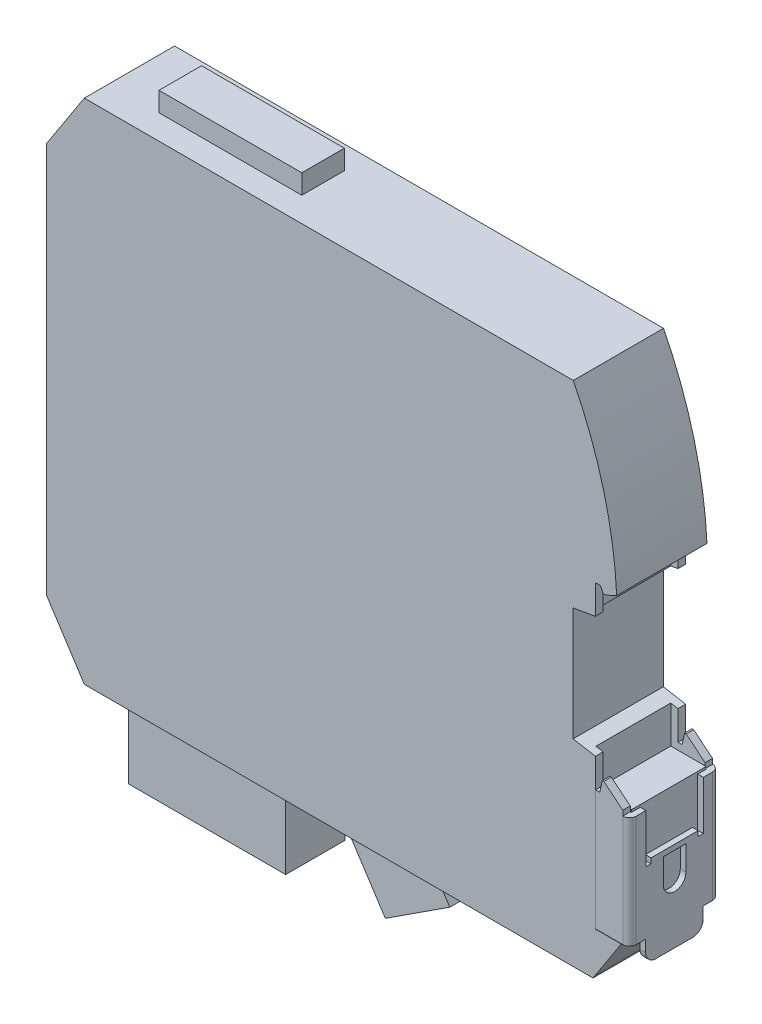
SolidWorks part; units mm, degrees
ref_plane "Front" through (0, 0, 0) normal (0, 0, 1) x (1, 0, 0)
ref_plane "Top" through (0, 0, 0) normal (0, 1, 0) x (1, 0, 0)
ref_plane "Right" through (0, 0, 0) normal (1, 0, 0) x (0, 0, -1)
sketch "Sketch1" plane through (0, 0, 0) normal (0, 0, 1) x (1, 0, 0)
  line L1 (57.2807, 0) -> (57.2807, -2.5863) construction
  line L2 (7.3383, 99) -> (9.1269, 99)
  line L3 (0, 87.7) -> (7.3383, 99)
  line L4 (-36.1695, 0) -> (36.1695, 0) construction
  line L5 (0, 0) -> (0, 109.5612) construction
  line L6 (75.1662, 0) -> (75.1662, -1.4017) construction
  line L7 (0, 11.3) -> (0, 87.7)
  line L12 (102.6923, 99) -> (176.6242, 99) construction
  line L13 (102.6923, 99) -> (102.6923, 151.5645) construction
  line L14 (0, 11.3) -> (0, -19.5306) construction
  line L15 (7.3383, 0) -> (0, 11.3)
  line L17 (7.3383, 0) -> (-18.9009, 0) construction
  line L26 (78.1, 0) -> (104.5, 0)
  line L29 (113.6, 6.2) -> (113.6, 4.2)
  line L31 (107, 8.5) -> (107, 14.7)
  line L33 (112.3, 31.2) -> (112.3, 30.2)
  line L34 (108.6, 34.2) -> (112.3, 31.2)
  line L35 (108.3, 34.2) -> (108.6, 34.2)
  line L36 (107.8, 32) -> (108.3, 34.2)
  line L37 (107, 32) -> (107.8, 32)
  line L38 (107, 28.7) -> (107, 32)
  line L42 (107, 23.5) -> (107, 27.7)
  line L45 (113.6, 30.2) -> (113.6, 8.5)
  line L46 (112.3, 30.2) -> (113.6, 30.2)
  line L47 (113.6, 8.5) -> (112.051, 8.5)
  line L49 (107, 0.7307) -> (107, 30.65)
  line L50 (112.051, 8.5) -> (107, 0.7307)
  line L52 (112.5, 8.5) -> (113.6, 8.5)
  line L53 (112.5, 6.2) -> (112.5, 8.5)
  line L82 (113.6, 8.5) -> (113.6, 6.2)
  line L83 (113.6, 4.2) -> (112.5, 4.2)
  line L84 (113.6, 6.2) -> (113.6, 4.2)
  line L85 (112.5, 4.2) -> (112.5, 6.2)
  line L87 (15, -13.5) -> (15, 0)
  line L88 (45.6, -13.5) -> (15, -13.5)
  line L89 (45.6, 0) -> (45.6, -13.5)
  line L90 (64.7314, -11.473) -> (57.2807, 0)
  line L91 (77.3114, -3.3034) -> (64.7314, -11.473)
  line L92 (75.1662, 0) -> (77.3114, -3.3034)
  line L113 (78.1, 0) -> (7.3383, 0)
  line L114 (82.3211, 6.5) -> (78.1, 0)
  line L115 (100.2789, 6.5) -> (82.3211, 6.5)
  line L116 (104.5, 0) -> (100.2789, 6.5)
  line L117 (106.5255, 0) -> (104.5, 0)
  line L118 (107, 0.7307) -> (106.5255, 0)
  line L119 (107, 37.683) -> (107, 0.7307)
  line L120 (102.65, 38.45) -> (107, 37.683)
  line L121 (102.65, 60.55) -> (102.65, 38.45)
  line L122 (107, 61.317) -> (102.65, 60.55)
  line L123 (107, 67) -> (107, 61.317)
  line L124 (108, 67) -> (107, 67)
  line L125 (108.5129, 65.9) -> (108, 67)
  line L126 (109, 65.9) -> (108.5129, 65.9)
  line L127 (111.1546, 66.9047) -> (109, 65.9)
  line L128 (99.7, 99) -> (102.6923, 99)
  line L129 (95.4789, 92.5) -> (99.7, 99)
  line L130 (60.7211, 92.5) -> (95.4789, 92.5)
  line L131 (56.5, 99) -> (60.7211, 92.5)
  line L132 (9.1269, 99) -> (56.5, 99)
  line L167 (44.95, 102.8) -> (17.1, 102.8)
  line L168 (44.95, 102.8) -> (44.95, 99)
  line L172 (17.1, 99) -> (17.1, 102.8)
  line L176 (56.5, 99) -> (99.7, 99)
  line L177 (60.7211, 92.5) -> (56.5, 99)
  line L192 (95.4789, 92.5) -> (60.7211, 92.5)
  line L193 (99.7, 99) -> (95.4789, 92.5)
  arc A3 (102.6923, 99) -> (111.1546, 66.9047) centre (31.25, 63) cw
  point P4 (7.4758, 0)
  point P9 (7.3442, 0)
extrude "Extrude1" add sketch "Sketch1" along normal mid plane 17.6
sketch "Sketch2" plane through (0, -13.5, 0) normal (0, -1, 0) x (1, 0, 0)
  line L0 (45.6, 8.8) -> (45.6, -8.8) construction
  line L1 (15, -8.8) -> (45.6, -8.8)
  line L2 (15, -8.8) -> (15, -3.8)
  line L3 (15, -3.8) -> (45.6, -3.8)
  line L4 (45.6, -8.8) -> (45.6, -3.8)
  line L5 (15, 8.8) -> (15, -8.8) construction
  line L6 (45.6, 8.8) -> (15, 8.8)
  line L7 (45.6, 8.8) -> (45.6, 7.8)
  line L8 (45.6, 7.8) -> (15, 7.8)
  line L9 (15, 8.8) -> (15, 7.8)
  line L10 (57.2807, 8.8) -> (45.6, 8.8) construction
  line L11 (45.6, 8.8) -> (15, 8.8) construction
  point P14 (0, 0)
  point P15 (0, 0)
  point P16 (45.6, 8.8)
  dimension "D1" = 1
  dimension "D2" = 5
extrude "Extrude2" cut sketch "Sketch2" against normal up to surface (13.5 mm away)
sketch "Sketch3" plane through (0, 0, 0) normal (0, -1, 0) x (1, 0, 0)
  line L0 (77.3114, 8.8) -> (77.3114, -8.8) construction
  line L1 (57.2807, 8.8) -> (77.3114, 8.8)
  line L2 (57.2807, 8.8) -> (57.2807, 7.5)
  line L3 (57.2807, 7.5) -> (77.3114, 7.5)
  line L4 (77.3114, 8.8) -> (77.3114, 7.5)
  line L6 (57.2807, -8.8) -> (77.3114, -8.8)
  line L7 (57.2807, -8.8) -> (57.2807, -7.5)
  line L8 (57.2807, -7.5) -> (77.3114, -7.5)
  line L9 (77.3114, -8.8) -> (77.3114, -7.5)
  dimension "D1" = 1.3
  dimension "D2" = 1.3
extrude "Extrude3" cut sketch "Sketch3" along normal blind 20
sketch "Sketch4" plane through (0, 102.8, 0) normal (0, 1, 0) x (1, 0, 0)
  line L0 (17.1, -8.8) -> (17.1, 8.8) construction
  line L1 (44.95, 8.8) -> (17.1, 8.8)
  line L2 (44.95, 8.8) -> (44.95, 4.3)
  line L3 (44.95, 4.3) -> (17.1, 4.3)
  line L4 (17.1, 8.8) -> (17.1, 4.3)
  line L5 (44.95, -8.8) -> (44.95, 8.8) construction
  line L6 (17.1, -8.8) -> (44.95, -8.8)
  line L7 (17.1, -8.8) -> (17.1, -4)
  line L8 (17.1, -4) -> (44.95, -4)
  line L9 (44.95, -8.8) -> (44.95, -4)
  dimension "D1" = 4.5
  dimension "D2" = 8.3
extrude "Extrude4" cut sketch "Sketch4" against normal up to surface (3.8 mm away)
sketch "Sketch5" plane through (0, 0, 0) normal (-1, 0, 0) x (0, 0, 1)
  line L0 (8.8, 99) -> (-8.8, 99) construction
  line L1 (-3.1, 79.3) -> (-3.1, 74.3) construction
  line L2 (0.55, 63.3) -> (0.55, 53.7457) construction
  line L3 (-8.8, 11.3) -> (-8.8, 87.7) construction
  circle A0 centre (-3.1, 79.3) radius 1.8
  circle A1 centre (-3.1, 74.3) radius 1.8
  circle A2 centre (0.55, 63.3) radius 3.5
  circle A3 centre (0.55, 54.3) radius 3.5
  point P15 (-3.1, 76.8)
  dimension "D1" = 19.7
  dimension "D2" = 24.7
  dimension "D3" = 35.7
  dimension "D5" = 7
  dimension "D6" = 3.6
  dimension "D4" = 44.7
  dimension "D7" = 9.35
  dimension "D8" = 5.7
extrude "Extrude5" cut sketch "Sketch5" against normal blind 1
sketch "Sketch6" plane through (0, 0, 0) normal (-1, 0, 0) x (0, 0, 1)
  line L0 (-8.8, 11.3) -> (-8.8, 87.7) construction
  line L1 (-3.6, 47.4) -> (2.4, 47.4)
  line L2 (-3.6, 47.4) -> (-3.6, 35.4)
  line L3 (-3.6, 35.4) -> (2.4, 35.4)
  line L4 (2.4, 47.4) -> (2.4, 35.4)
  line L5 (-4.1, 27.4) -> (0.9, 27.4)
  line L6 (-4.1, 27.4) -> (-4.1, 19.4)
  line L7 (-4.1, 19.4) -> (0.9, 19.4)
  line L8 (0.9, 27.4) -> (0.9, 19.4)
  line L9 (4, 99) -> (-4.3, 99) construction
  dimension "D1" = 6
  dimension "D2" = 12
  dimension "D3" = 5.2
  dimension "D4" = 51.6
  dimension "D5" = 71.6
  dimension "D6" = 8
  dimension "D7" = 5
  dimension "D8" = 4.7
extrude "Extrude6" cut sketch "Sketch6" against normal blind 1
sketch "Sketch8" plane through (113.6, 0, -113.6) normal (-1, 0, 0) x (0, 0, -1)
  line L0 (-104.8, -4.2) -> (-79.7088, -4.2) construction
  line L1 (-104.8, -4.2) -> (-104.8, -42.7808) construction
  line L2 (-104.8, -60.55) -> (-104.8, -38.45) construction
  line L3 (-104.8, -34.2) -> (-97.9981, -34.2) construction
  line L4 (-102.7827, -36.3513) -> (-125.1866, -36.3513)
  line L5 (-102.7827, -36.3513) -> (-102.7827, -2.5223)
  line L6 (-102.7827, -2.5223) -> (-125.1866, -2.5223)
  line L7 (-125.1866, -36.3513) -> (-125.1866, -2.5223)
  line L8 (-122.35, 6.6342) -> (-122.35, -39.9769) construction
  line L9 (-122.4, 0) -> (-122.4, -11.3) construction
  line L16 (-108.95, -20.7) -> (-107.95, -20.7)
  line L17 (-107.95, -20.7) -> (-107.95, -30.2)
  line L18 (-107.95, -30.2) -> (-105.85, -30.2)
  line L20 (-106.15, -8.5) -> (-108, -8.5)
  line L21 (-108, -8.5) -> (-108, -6.2)
  line L22 (-110, -4.2) -> (-117.2, -4.2)
  line L23 (-119.2, -6.2) -> (-119.2, -8.5)
  line L24 (-119.2, -8.5) -> (-121.05, -8.5)
  line L26 (-121.35, -30.2) -> (-119.15, -30.2)
  line L27 (-119.15, -30.2) -> (-119.15, -20.7)
  line L28 (-119.15, -20.7) -> (-118.15, -20.7)
  line L29 (-118.15, -20.7) -> (-118.15, -21.7)
  line L30 (-118.15, -21.7) -> (-108.95, -21.7)
  line L31 (-108.95, -21.7) -> (-108.95, -20.7)
  line L98 (-105.85, -31.2) -> (-105.85, -34.2)
  line L99 (-105.85, -34.2) -> (-104.85, -34.2)
  line L100 (-104.85, -34.2) -> (-104.85, -31.2)
  line L101 (-105.85, -30.2) -> (-105.85, -31.2)
  line L102 (-104.85, -31.2) -> (-104.85, -30.2)
  line L105 (-104.85, -30.2) -> (-104.85, -8.5)
  line L106 (-104.85, -8.5) -> (-106.15, -8.5)
  line L107 (-108.95, -20.7) -> (-107.95, -20.7)
  line L108 (-107.95, -20.7) -> (-107.95, -30.2)
  line L109 (-107.95, -30.2) -> (-105.85, -30.2)
  line L110 (-106.15, -8.5) -> (-108, -8.5)
  line L111 (-108, -8.5) -> (-108, -6.2)
  line L112 (-110, -4.2) -> (-117.2, -4.2)
  line L113 (-119.2, -6.2) -> (-119.2, -8.5)
  line L120 (-119.2, -8.5) -> (-121.05, -8.5)
  line L121 (-121.35, -30.2) -> (-119.15, -30.2)
  line L122 (-119.15, -30.2) -> (-119.15, -20.7)
  line L123 (-119.15, -20.7) -> (-118.15, -20.7)
  line L124 (-118.15, -20.7) -> (-118.15, -21.7)
  line L125 (-118.15, -21.7) -> (-108.95, -21.7)
  line L126 (-108.95, -21.7) -> (-108.95, -20.7)
  line L127 (-121.05, -8.5) -> (-122.35, -8.5)
  line L128 (-122.35, -8.5) -> (-122.35, -30.2)
  line L130 (-121.35, -31.2) -> (-121.35, -30.2)
  line L132 (-122.35, -30.2) -> (-122.35, -31.2)
  line L133 (-122.35, -31.2) -> (-122.35, -34.2)
  line L134 (-122.35, -34.2) -> (-121.35, -34.2)
  line L135 (-121.35, -34.2) -> (-121.35, -31.2)
  line L137 (-111.35, -20.7) -> (-111.35, -15.9)
  line L138 (-115.75, -20.7) -> (-115.75, -15.9)
  line L139 (-111.35, -20.7) -> (-115.75, -20.7)
  arc A2 (-108, -6.2) -> (-110, -4.2) centre (-110, -6.2) ccw
  arc A3 (-117.2, -4.2) -> (-119.2, -6.2) centre (-117.2, -6.2) ccw
  arc A8 (-108, -6.2) -> (-110, -4.2) centre (-110, -6.2) ccw
  arc A9 (-117.2, -4.2) -> (-119.2, -6.2) centre (-117.2, -6.2) ccw
  arc A12 (-111.35, -15.9) -> (-115.75, -15.9) centre (-113.55, -15.9) ccw
  dimension "D1" = 0.05
extrude "Extrude7" cut sketch "Sketch8" along normal blind 1.1 contours L4 L7 L6 L5 L22 A3 L23 L21 A2 M142 M141 M144 M143 | A12 L137 L139 L138 | L135 L130 L26 L27 L28 L29 L30 L31 L16 L17 L18 L101 L98 M144 | A3 L23 L24 L127 L128 M144 M142 M143 | L21 A2 L106 L20 M144 M141
sketch "Sketch9" plane through (112.3, 0, 0) normal (1, 0, 0) x (0, 0, -1)
  line L0 (-8.8, 32) -> (-8.8, 37.683) construction
  line L1 (-7.3, 65.9) -> (7.3, 65.9)
  line L2 (-7.3, 65.9) -> (-7.3, 30.65)
  line L3 (-7.3, 30.65) -> (7.3, 30.65)
  line L4 (7.3, 65.9) -> (7.3, 30.65)
  line L5 (8.8, 32) -> (8.8, 37.683) construction
  line L6 (-8.8, 65.9) -> (8.8, 65.9) construction
  dimension "D1" = 1.5
  dimension "D2" = 1.5
  dimension "D3" = 35.25
extrude "Extrude8" cut sketch "Sketch9" against normal blind 6.7
sketch "Sketch10" plane through (113.6, 0, 0) normal (1, 0, 0) x (0, 0, -1)
  line L0 (-8.8, 8.5) -> (-8.8, 0.7307) construction
  line L1 (8.8, 35.0394) -> (8.75, 35.0394)
  line L2 (8.8, 35.0394) -> (8.8, 8.5)
  line L3 (8.8, 8.5) -> (8.75, 8.5)
  line L4 (8.75, 35.0394) -> (8.75, 8.5)
  line L5 (-8.8, 8.5) -> (-8.75, 8.5)
  line L6 (-8.8, 8.5) -> (-8.8, 35.5719)
  line L7 (-8.8, 35.5719) -> (-8.75, 35.5719)
  line L8 (-8.75, 8.5) -> (-8.75, 35.5719)
  line L9 (8.8, 34.2) -> (8.8, 31.2) construction
  line L10 (8.8, 32) -> (8.8, 37.683) construction
  line L11 (-5.6, 8.5) -> (-8.75, 8.5) construction
  line L12 (-8.8, 8.5) -> (8.8, 8.5) construction
  line L13 (8.75, 8.5) -> (5.6, 8.5) construction
  dimension "D1" = 0.05
  dimension "D2" = 0.05
extrude "Extrude9" cut sketch "Sketch10" against normal blind 6.6
sketch "Sketch11" plane through (112.3, 0, 0) normal (1, 0, 0) x (0, 0, -1)
  line L0 (-8.75, 30.2) -> (8.75, 30.2) construction
  line L1 (7.3, 30.65) -> (-7.3, 30.65)
  line L2 (7.3, 30.65) -> (7.3, 30.2)
  line L3 (7.3, 30.2) -> (-7.3, 30.2)
  line L4 (-7.3, 30.65) -> (-7.3, 30.2)
extrude "Extrude10" add sketch "Sketch11" along normal up to surface (0.2 mm away)
fillet "Fillet1" radius 1.3 2 edges at (113.6, 19.35, -8.75) (113.6, 19.35, 8.75)
